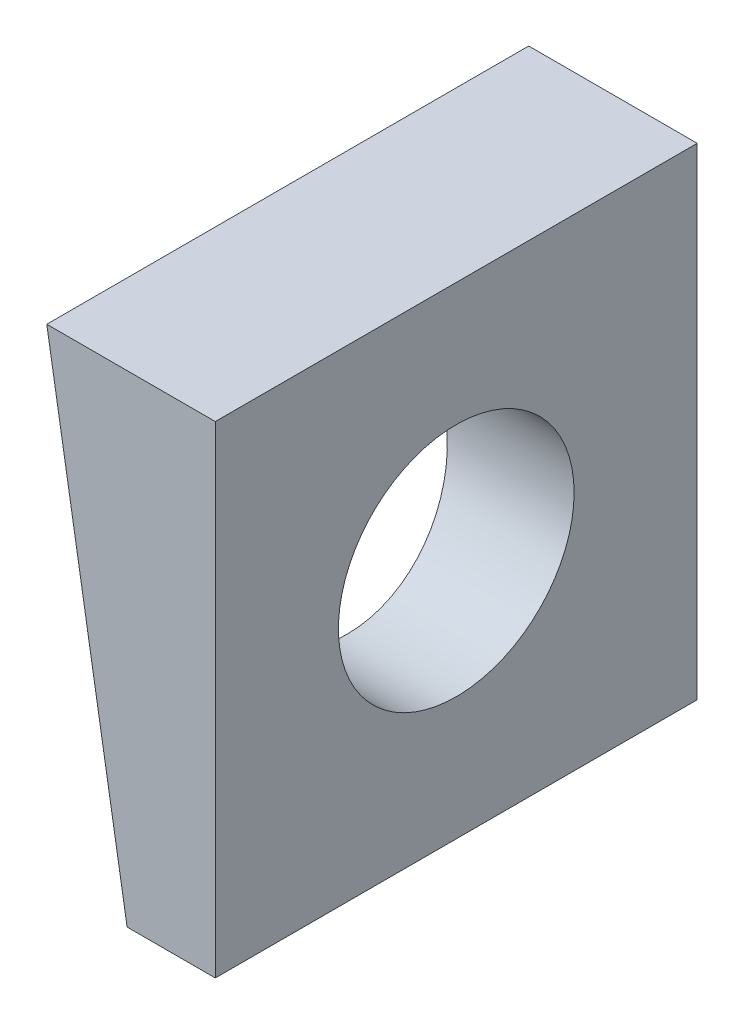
SolidWorks part; units mm, degrees
ref_plane "Plane1" through (0, 0, 0) normal (0, 0, 1) x (1, 0, 0)
ref_plane "Plane2" through (0, 0, 0) normal (0, 1, 0) x (1, 0, 0)
ref_plane "Plane3" through (0, 0, 0) normal (1, 0, 0) x (0, 0, -1)
sketch "Sketch1" plane through (0, 0, 0) normal (0, 0, 1) x (1, 0, 0)
  line L0 (0, 0) -> (-7.9502, 0) construction
  line L1 (-5.4631, -14.9225) -> (0, -14.9225)
  line L2 (0, 7.2987) -> (-9.1667, 7.2987) construction
  line L3 (0, -14.9225) -> (0, 14.9225)
  line L4 (0, 14.9225) -> (-10.4373, 14.9225)
  line L5 (-5.4631, -14.9225) -> (-10.4373, 14.9225)
  line L6 (0, -7.2987) -> (-6.7337, -7.2987) construction
  line L10 (-4.5833, 7.2987) -> (-4.5833, -7.2987) construction
  point P11 (-4.5833, 0)
  point P13 (0, 0)
extrude "Boss-Extrude1" add sketch "Sketch1" along normal mid plane 29.845
sketch "Sketch2" plane through (0, 0, 0) normal (1, 0, 0) x (0, 0, -1)
  circle A0 centre (0, 0) radius 7.2987
extrude "Cut-Extrude1" cut sketch "Sketch2" against normal through all
equation "\"D1@Boss-Extrude1\"=\"Outside_len@Sketch1\""
